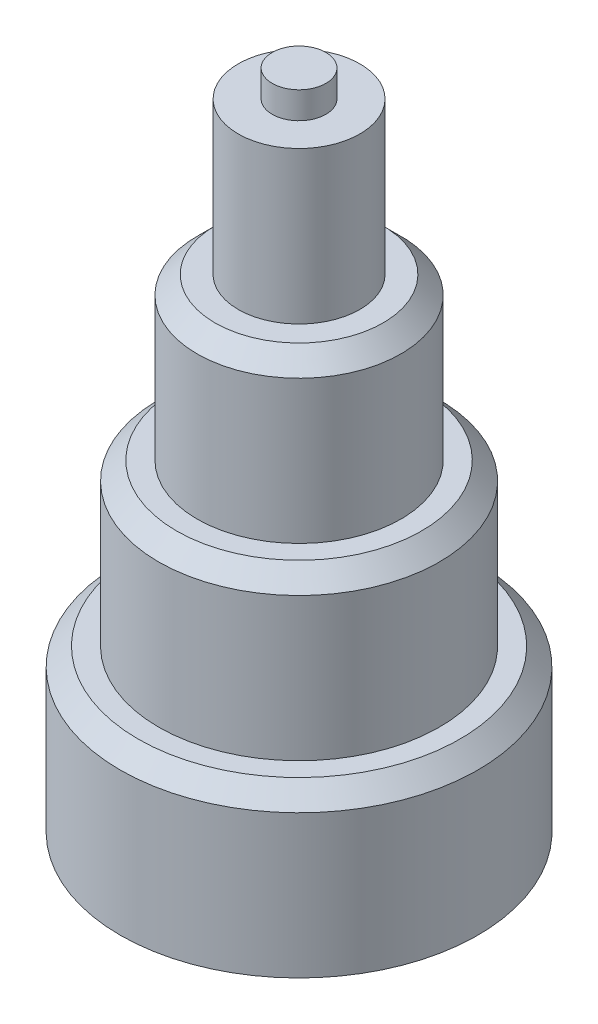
SolidWorks part; units mm, degrees
ref_plane "Front Plane" through (0, 0, 0) normal (0, 0, 1) x (1, 0, 0)
ref_plane "Top Plane" through (0, 0, 0) normal (0, 1, 0) x (1, 0, 0)
ref_plane "Right Plane" through (0, 0, 0) normal (1, 0, 0) x (0, 0, -1)
sketch "Sketch1" plane through (0, 0, 0) normal (0, 1, 0) x (1, 0, 0)
  circle A0 centre (0, 0) radius 10
  dimension "D1" = 20
extrude "Boss-Extrude1" add sketch "Sketch1" along normal blind 9
sketch "Sketch2" plane through (0, 9, 0) normal (0, 1, 0) x (1, 0, 0)
  circle A0 centre (0, 0) radius 7.85
  dimension "D1" = 15.7
extrude "Boss-Extrude2" add sketch "Sketch2" along normal blind 9
sketch "Sketch3" plane through (0, 18, 0) normal (0, 1, 0) x (1, 0, 0)
  circle A0 centre (0, 0) radius 5.7
  dimension "D1" = 11.4
extrude "Boss-Extrude3" add sketch "Sketch3" along normal blind 9
sketch "Sketch4" plane through (0, 27, 0) normal (0, 1, 0) x (1, 0, 0)
  circle A0 centre (0, 0) radius 3.4
  dimension "D1" = 6.8
extrude "Boss-Extrude4" add sketch "Sketch4" along normal blind 8.5
sketch "Sketch5" plane through (0, 35.5, 0) normal (0, 1, 0) x (1, 0, 0)
  circle A0 centre (0, 0) radius 1.5
  dimension "D1" = 3
extrude "Boss-Extrude5" add sketch "Sketch5" along normal blind 1.5
chamfer "Chamfer1" distance 1 angle 45 3 edges at (0, 27, 5.7) (0, 18, 7.85) (0, 9, 10)
hole_wizard "M5x0.8 Tapped Hole1" positions "Sketch7" profile "Sketch6" tap size "M5x0.8" standard "ANSI Metric"
sketch "Sketch7" plane through (0, 0, 0) normal (0, -1, 0) x (-1, 0, 0)
  point P0 (0, 0)
sketch "Sketch6" plane through (0, 0, 0) normal (1, 0, 0) x (0, 0, -1)
  line L0 (0, 0) -> (0, 18.6618)
  line L1 (0, 18.6618) -> (2.1, 17.4)
  line L2 (2.1, 17.4) -> (2.1, 0)
  line L5 (2.1, 0) -> (0, 0)
  line L10 (0, 18.6618) -> (-2.1, 17.4) construction
  line L11 (0, -6.35) -> (0, 107.95) construction
  dimension "Tap Drill Dia." = 4.2
  dimension "Tap Drill Depth" = 17.4
  dimension "Drill Angle" = 118
